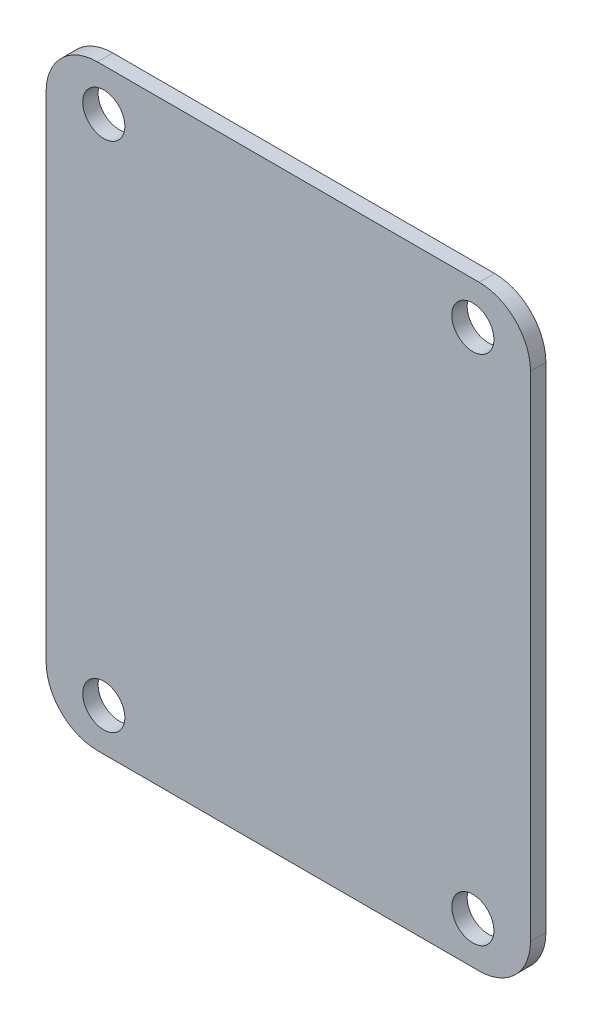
SolidWorks part; units mm, degrees
ref_plane "Front Plane" through (0, 0, 0) normal (0, 0, 1) x (1, 0, 0)
ref_plane "Top Plane" through (0, 0, 0) normal (0, 1, 0) x (1, 0, 0)
ref_plane "Right Plane" through (0, 0, 0) normal (1, 0, 0) x (0, 0, -1)
sketch "Sketch1" plane through (0, 0, 0) normal (0, 0, 1) x (1, 0, 0)
  line L0 (7.1978, 22.5684) -> (7.1978, -21.2436) construction
  line L1 (5.9278, -22.5136) -> (-5.7161, -22.5136) construction
  line L2 (12.1004, 4.4866) -> (12.1004, -19.9736)
  line L3 (0.1059, 4.9374) -> (0.1059, -22.5136) construction
  line L4 (-9.0329, 4.9374) -> (9.2446, 4.9374) construction
  line L5 (-9.3486, 7.0266) -> (9.5604, 7.0266)
  line L6 (-11.8886, 4.4866) -> (-11.8886, -19.9736)
  line L7 (-9.3486, -22.5136) -> (9.5604, -22.5136)
  circle A0 centre (-9.0329, 4.9374) radius 1.0427
  circle A1 centre (9.2446, 4.9374) radius 1.0427
  circle A2 centre (9.2446, -20.4244) radius 1.0427
  circle A3 centre (-9.0329, -20.4244) radius 1.0427
  arc A4 (12.1004, 4.4866) -> (9.5604, 7.0266) centre (9.5604, 4.4866) ccw
  arc A5 (12.1004, -19.9736) -> (9.5604, -22.5136) centre (9.5604, -19.9736) cw
  arc A6 (-9.3486, -22.5136) -> (-11.8886, -19.9736) centre (-9.3486, -19.9736) cw
  arc A7 (-11.8886, 4.4866) -> (-9.3486, 7.0266) centre (-9.3486, 4.4866) cw
  point P20 (12.1004, 7.0266)
  point P23 (12.1004, -22.5136)
  point P26 (-11.8886, -22.5136)
  point P29 (-11.8886, 7.0266)
  dimension "D1" = 2.54
extrude "Boss-Extrude1" add sketch "Sketch1" along normal blind 0.762
